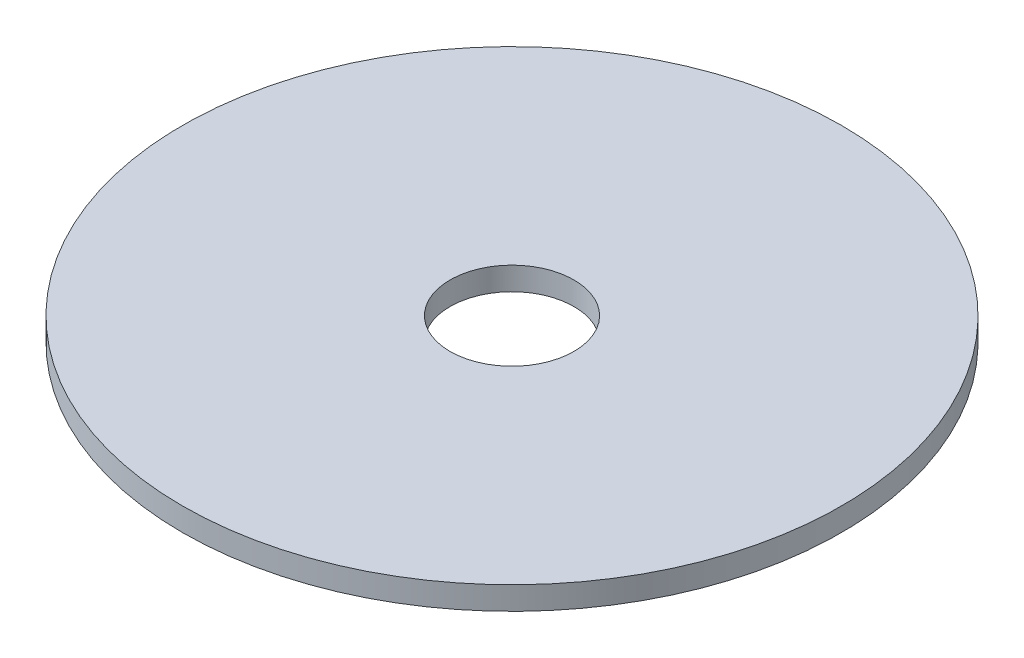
SolidWorks part; units mm, degrees
ref_plane "Front Plane" through (0, 0, 0) normal (0, 0, 1) x (1, 0, 0)
ref_plane "Top Plane" through (0, 0, 0) normal (0, 1, 0) x (1, 0, 0)
ref_plane "Right Plane" through (0, 0, 0) normal (1, 0, 0) x (0, 0, -1)
sketch "Sketch1" plane through (0, 0, 0) normal (0, 1, 0) x (1, 0, 0)
  circle A0 centre (0, 0) radius 12.7
  dimension "OD" = 25.4
extrude "Boss-Extrude1" add sketch "Sketch1" along normal blind 0.889
sketch "Sketch5" plane through (0, 0.889, 0) normal (0, 1, 0) x (-1, 0, 0)
  circle A0 centre (0, 0) radius 2.3876
  dimension "ID" = 4.7752
extrude "Cut-Extrude1" cut sketch "Sketch5" against normal through all
